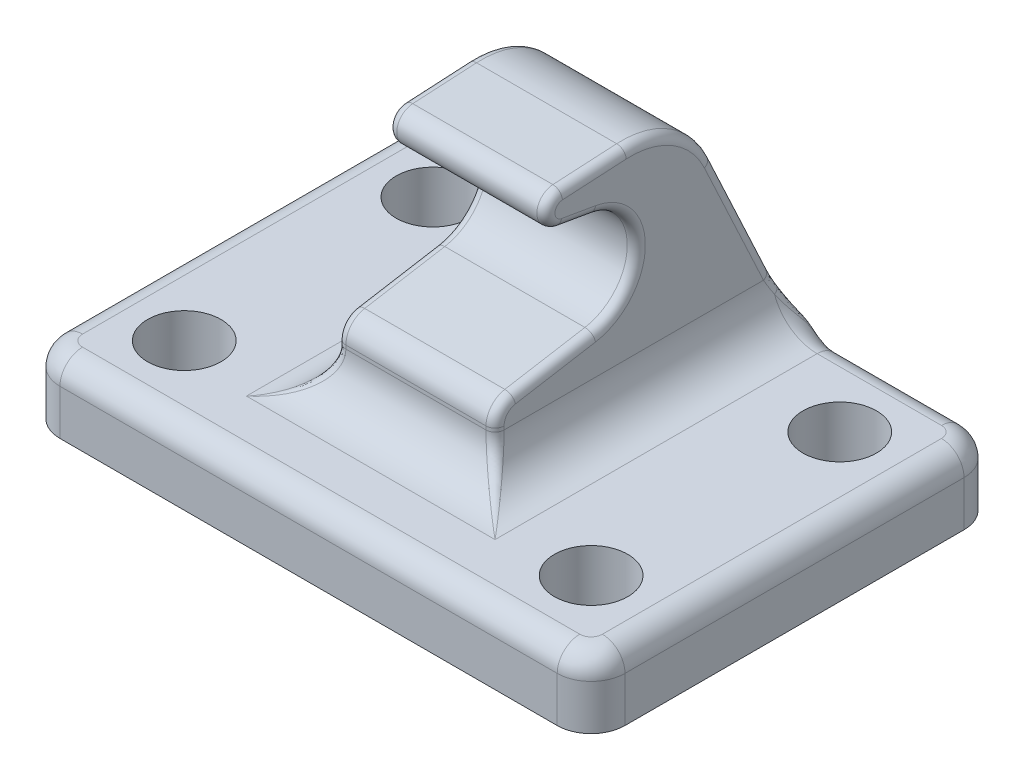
SolidWorks part; units mm, degrees
ref_plane "front" through (0, 0, 0) normal (0, 0, 1) x (1, 0, 0)
ref_plane "top" through (0, 0, 0) normal (0, 1, 0) x (1, 0, 0)
ref_plane "right" through (0, 0, 0) normal (1, 0, 0) x (0, 0, -1)
sketch "Sketch1" plane through (0, 0, 0) normal (0, 1, 0) x (1, 0, 0)
  line L1 (0, 0) -> (79.375, 0)
  line L2 (0, 0) -> (0, 57.15)
  line L3 (0, 57.15) -> (79.375, 57.15)
  line L4 (79.375, 0) -> (79.375, 57.15)
  dimension "D1" = 79.375
  dimension "D2" = 57.15
extrude "Base-Extrude" add sketch "Sketch1" along normal blind 9.525
sketch "Sketch2" plane through (0, 9.525, 0) normal (0, 1, 0) x (-1, 0, 0)
  line L0 (0, -57.15) -> (0, 0) construction
  line L1 (0, 0) -> (-79.375, 0) construction
  circle A0 centre (-11.1125, -46.0375) radius 5.1562
  circle A1 centre (-11.1125, -11.1125) radius 5.1562
  circle A2 centre (-68.2625, -11.1125) radius 5.1562
  circle A3 centre (-68.2625, -46.0375) radius 5.1562
  dimension "D1" = 10.3124
  dimension "D2" = 34.925
  dimension "D3" = 57.15
  dimension "D4" = 11.1125
  dimension "D5" = 11.1125
extrude "Cut-Extrude1" cut sketch "Sketch2" against normal through all
ref_plane "Plane4" through (39.6875, 0, 0) normal (1, 0, 0) x (0, 0, -1)
sketch "Sketch3" plane through (39.6875, 0, 0) normal (1, 0, 0) x (0, 0, -1)
  line L0 (0, 9.525) -> (57.15, 9.525) construction
  line L1 (15.0812, 9.525) -> (57.15, 9.525)
  line L2 (57.15, 9.525) -> (45.6421, 34.2125)
  line L3 (33.436, 41.5277) -> (24.4759, 41.0365)
  line L4 (24.2027, 36.312) -> (28.992, 35.4884)
  line L5 (28.9749, 21.4047) -> (17.7257, 19.4982)
  line L6 (15.0812, 16.3678) -> (15.0812, 9.525)
  line L7 (0, 9.525) -> (0, 0) construction
  arc A0 (24.4759, 41.0365) -> (24.2027, 36.312) centre (24.6062, 38.6588) ccw
  arc A1 (28.992, 35.4884) -> (28.9749, 21.4047) centre (27.7812, 28.448) cw
  arc A2 (33.436, 41.5277) -> (45.6421, 34.2125) centre (34.1313, 28.8468) cw
  arc A3 (15.0812, 16.3678) -> (17.7257, 19.4982) centre (18.2562, 16.3678) cw
  point P18 (15.0812, 19.05)
  dimension "D1" = 12.7
  dimension "D2" = 2.3813
  dimension "D3" = 7.1437
  dimension "D5" = 29.1338
  dimension "D6" = 34.1313
  dimension "D7" = 19.3218
  dimension "D9" = 18.923
  dimension "D12" = 3.175
  dimension "D4" = 24.6062
  dimension "D8" = 27.7812
  dimension "D10" = 15.0812
  dimension "D11" = 9.525
extrude "Boss-Extrude1" add sketch "Sketch3" along normal mid plane 22.225
fillet "Fillet1" radius 4.7625 4 edges at (0, 4.7625, -57.15) (79.375, 4.7625, -57.15) (79.375, 4.7625, 0) (0, 4.7625, 0)
fillet "Fillet3" radius 3.175 9 edges at (16.6687, 9.525, -57.15) (39.6875, 9.525, 0) (0, 9.525, -28.575) (79.375, 9.525, -28.575) (62.7062, 9.525, -57.15) (77.9801, 9.525, -55.7551) (1.3949, 9.525, -55.7551) (77.9801, 9.525, -1.3949) (1.3949, 9.525, -1.3949)
fillet "Fillet5" radius 6.35 7 edges at (28.575, 9.525, -34.5281) (39.6875, 9.525, -15.0812) (50.8, 9.525, -34.5281) (50.8, 7.9375, -57.15) (28.575, 7.9375, -57.15) (28.575, 8.5951, -56.2201) (50.8, 8.5951, -56.2201)
fillet "Fillet6" radius 3.175 3 edges at (55.1094, 7.8507, -57.15) (28.3543, 14.1492, -54.9945) (39.6875, 9.525, -57.15)
sketch "Sketch4" plane through (0, 0, 0) normal (0, -1, 0) x (1, 0, 0)
  line L0 (0, -28.575) -> (79.375, -28.575) construction
  line L1 (0, -52.3875) -> (0, -4.7625) construction
  line L2 (79.375, -4.7625) -> (79.375, -52.3875) construction
  line L4 (20.6375, -38.1) -> (58.7375, -38.1)
  line L5 (20.6375, -38.1) -> (20.6375, -19.05)
  line L6 (20.6375, -19.05) -> (58.7375, -19.05)
  line L7 (58.7375, -38.1) -> (58.7375, -19.05)
  line L8 (20.6375, -38.1) -> (58.7375, -19.05) construction
  line L9 (20.6375, -19.05) -> (58.7375, -38.1) construction
  point P6 (39.6875, -28.575)
  dimension "D1" = 19.05
  dimension "D2" = 38.1
extrude "Cut-Extrude2" cut sketch "Sketch4" against normal blind 3.175
fillet "Fillet7" radius 1.27 26 edges at (55.1094, 7.8507, -57.15) (53.1175, 9.8641, -56.9739) (51.3035, 13.2484, -55.4144) (52.6599, 11.3849, -13.2214) (50.8, 16.1214, -15.0812) (50.8, 18.4167, -15.8309) (50.8, 20.4514, -23.3503) (50.8, 28.4394, -34.925) (50.8, 35.9002, -26.5973) (50.8, 38.7963, -22.229) (50.8, 41.2821, -28.9559) (50.8, 39.7402, -40.6598) (24.2656, 7.8507, -57.15) (25.7647, 9.2058, -57.1266) (28.3543, 14.1492, -54.9945) (26.7151, 11.3849, -13.2214) (28.575, 16.1214, -15.0812) (28.575, 18.4167, -15.8309) (28.575, 20.4514, -23.3503) (28.575, 28.4394, -34.925) (28.575, 35.9002, -26.5973) (28.575, 38.7963, -22.229) (28.575, 41.2821, -28.9559) (28.575, 39.7402, -40.6598) (50.8, 25.0425, -49.9166) (28.575, 25.0425, -49.9166)
equation "\"1.1.44852952in\"=1.44853"
